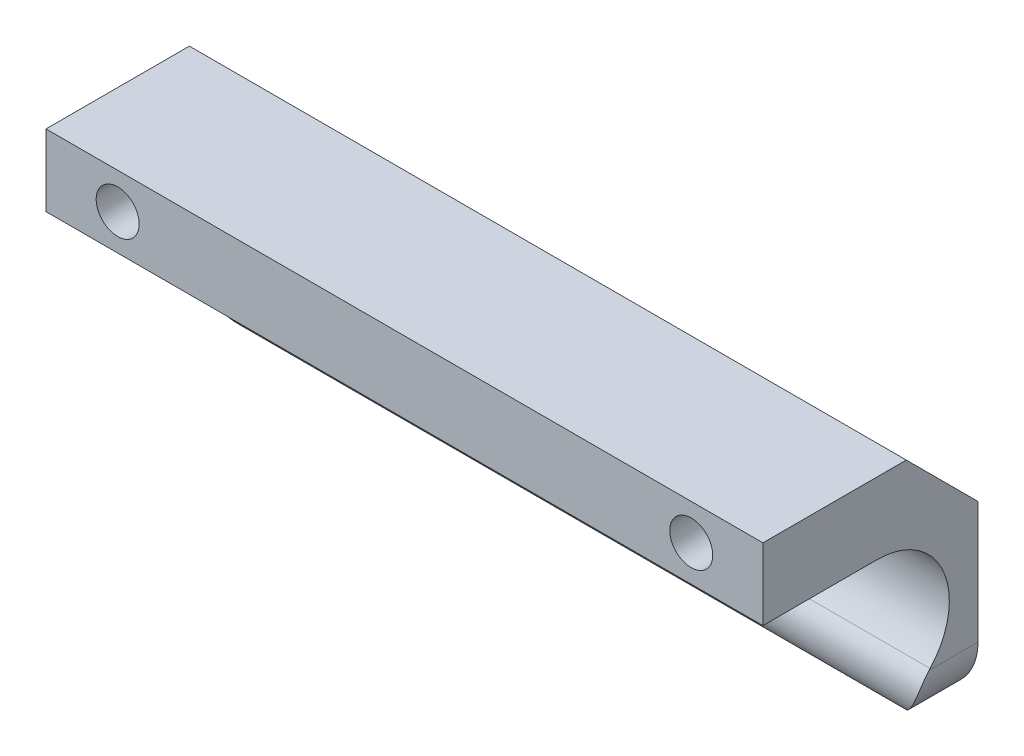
SolidWorks part; units mm, degrees
ref_plane "Front Plane" through (0, 0, 0) normal (0, 0, 1) x (1, 0, 0)
ref_plane "Top Plane" through (0, 0, 0) normal (0, 1, 0) x (1, 0, 0)
ref_plane "Right Plane" through (0, 0, 0) normal (1, 0, 0) x (0, 0, -1)
sketch "Sketch1" plane through (0, 0, 0) normal (1, 0, 0) x (0, 0, -1)
  line L1 (-15, -17.5) -> (15, -17.5)
  line L2 (-15, -17.5) -> (-15, 17.5)
  line L3 (-15, 17.5) -> (15, 17.5)
  line L4 (15, -17.5) -> (15, 17.5)
  line L5 (-15, -17.5) -> (15, 17.5) construction
  line L6 (-15, 17.5) -> (15, -17.5) construction
  point P0 (0, 0)
  dimension "D1" = 30
  dimension "D2" = 35
extrude "Extrude1" add sketch "Sketch1" along normal mid plane 100
chamfer "Chamfer1" distance 10 angle 45 1 edges at (0, 17.5, -15)
sketch "Sketch2" plane through (50, 0, 0) normal (1, 0, 0) x (0, 0, -1)
  line L0 (1, 7.5) -> (-15, 7.5)
  line L2 (-15, 17.5) -> (-15, -17.5) construction
  line L3 (5, 17.5) -> (-15, 17.5) construction
  line L4 (15, -17.5) -> (15, 7.5) construction
  line L7 (-15, -17.5) -> (15, -17.5) construction
  line L8 (15, -16.347) -> (15, -17.5)
  line L9 (15, -17.5) -> (-15, -17.5)
  line L10 (-15, -17.5) -> (-15, 7.5)
  arc A0 (8.3078, -9.3261) -> (15, -16.347) centre (11.8579, -12.6421) ccw
  arc A1 (8.3078, -9.3261) -> (1, 7.5) centre (1, -2.5) ccw
  point P3 (11, -2.5)
  point P16 (7, -12.6421)
  point P18 (11.8579, -17.5)
  dimension "D3" = 10
  dimension "D1" = 10
  dimension "D2" = 4
  dimension "D4" = 8
extrude "Extrude2" cut sketch "Sketch2" against normal blind 100 contours A0 A1 L0 M4 M5 | A0 L9 M1
sketch "Sketch3" plane through (0, 0, -15) normal (0, 0, -1) x (-1, 0, 0)
  line L0 (-50, -17.5) -> (-50, -9.5)
  line L1 (-50, -16.347) -> (-50, 7.5) construction
  line L2 (-50, -17.5) -> (50, -17.5) construction
  line L3 (-42, -17.5) -> (-50, -17.5)
  line L4 (50, -17.5) -> (50, -9.5)
  line L5 (50, -16.347) -> (50, 7.5) construction
  line L6 (50, -17.5) -> (42, -17.5)
  arc A0 (-50, -9.5) -> (-42, -17.5) centre (-42, -9.5) ccw
  arc A1 (42, -17.5) -> (50, -9.5) centre (42, -9.5) ccw
  dimension "D1" = 8
extrude "Extrude3" cut sketch "Sketch3" against normal through all
hole_wizard "M6x1.0 Tapped Hole1" positions "Sketch5" profile "Sketch4" tap size "M6x1.0" standard "Ansi Metric"
sketch "Sketch5" plane through (0, 0, 15) normal (0, 0, 1) x (1, 0, 0)
  line L0 (-50, 17.5) -> (-50, 7.5) construction
  line L1 (50, 17.5) -> (-50, 17.5) construction
  point P0 (-40, 12.5)
  point P2 (-50, 12.5)
  dimension "D1" = 10
  dimension "D2" = 5
sketch "Sketch4" plane through (-40, 12.5, 15) normal (1, 0, 0) x (0, -1, 0)
  line L0 (0, 0) -> (0, 18.5022)
  line L1 (0, 18.5022) -> (2.5, 17)
  line L2 (2.5, 17) -> (2.5, 12)
  line L3 (2.5, 12) -> (3, 12)
  line L4 (3, 12) -> (3, 0)
  line L5 (3, 0) -> (0, 0)
  line L10 (0, 18.5022) -> (-2.5, 17) construction
  line L11 (0, -6.35) -> (0, 107.95) construction
  dimension "Tap Drill Dia." = 5
  dimension "Tap Drill Depth" = 17
  dimension "Thread Major Dia." = 6
  dimension "Thread Depth" = 12
  dimension "Drill Angle" = 118
mirror "Mirror1" about plane through (0, 0, 0) normal (1, 0, 0) of "M6x1.0 Tapped Hole1"
